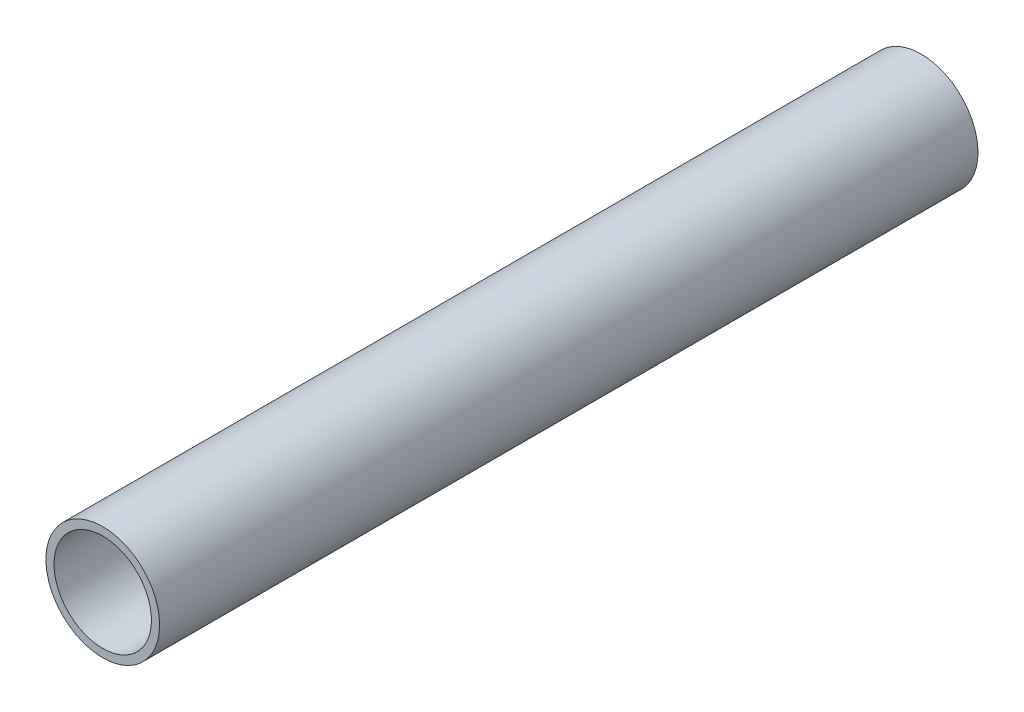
SolidWorks part; units mm, degrees
ref_plane "Plan de face" through (0, 0, 0) normal (0, 0, 1) x (1, 0, 0)
ref_plane "Plan de dessus" through (0, 0, 0) normal (0, 1, 0) x (1, 0, 0)
ref_plane "Plan de droite" through (0, 0, 0) normal (1, 0, 0) x (0, 0, -1)
sketch "Esquisse1" plane through (0, 0, 0) normal (0, 0, 1) x (1, 0, 0)
  circle A0 centre (0, 0) radius 17.5
  dimension "D1" = 35
extrude "Extru.-Mince1" add sketch "Esquisse1" along normal blind 252 thin
